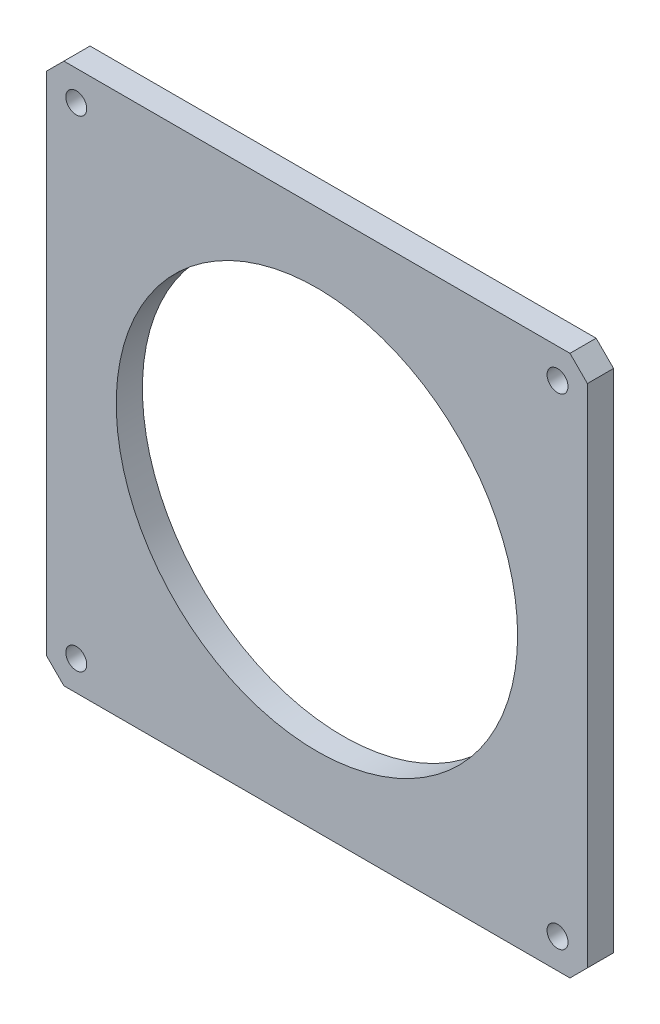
SolidWorks part; units mm, degrees
ref_plane "Plan de face" through (0, 0, 0) normal (0, 0, 1) x (1, 0, 0)
ref_plane "Plan de dessus" through (0, 0, 0) normal (0, 1, 0) x (1, 0, 0)
ref_plane "Plan de droite" through (0, 0, 0) normal (1, 0, 0) x (0, 0, -1)
sketch "Esquisse1" plane through (0, 0, 0) normal (0, 0, 1) x (1, 0, 0)
  line L0 (-310, 290) -> (-290, 310)
  line L1 (-290, -310) -> (290, -310)
  line L2 (-310, -290) -> (-310, 290)
  line L3 (-290, 310) -> (290, 310)
  line L4 (310, -290) -> (310, 290)
  line L5 (-310, -310) -> (310, 310) construction
  line L6 (-310, 310) -> (310, -310) construction
  line L7 (290, 310) -> (310, 290)
  line L8 (290, -310) -> (310, -290)
  line L9 (-310, -290) -> (-290, -310)
  circle A0 centre (-275.7716, 275.7716) radius 12
  circle A1 centre (275.7716, 275.7716) radius 12
  circle A2 centre (-275.7716, -275.7716) radius 12
  circle A3 centre (275.7716, -275.7716) radius 12
  circle A4 centre (0, 0) radius 230
  point P0 (0, 0)
  dimension "D4" = 24
  dimension "D5" = 460
  dimension "D3" = 390
  dimension "D1" = 620
  dimension "D2" = 620
extrude "Boss.-Extru.1" add sketch "Esquisse1" along normal blind 30
